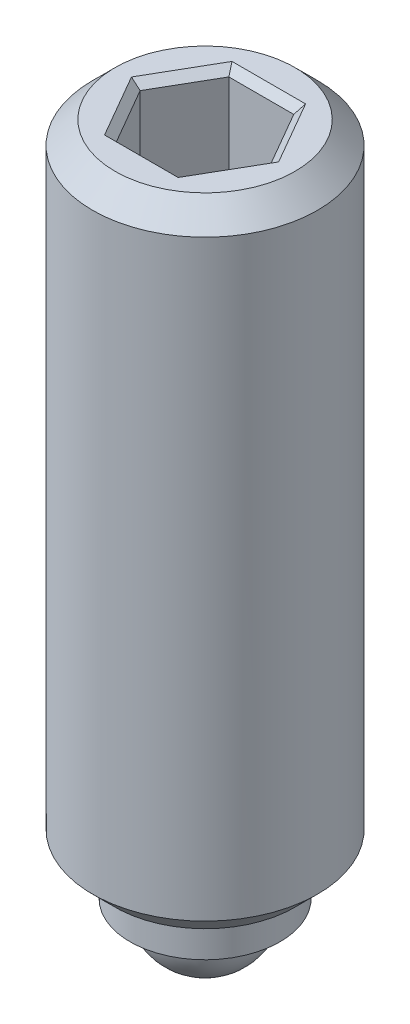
SolidWorks part; units mm, degrees
ref_plane "Plan de face" through (0, 0, 0) normal (0, 0, 1) x (1, 0, 0)
ref_plane "Plan de dessus" through (0, 0, 0) normal (0, 1, 0) x (1, 0, 0)
ref_plane "Plan de droite" through (0, 0, 0) normal (1, 0, 0) x (0, 0, -1)
sketch "Esquisse1" plane through (0, 0, 0) normal (0, 0, 1) x (1, 0, 0)
  line L0 (0, 0) -> (0, 9)
  line L1 (0, 9) -> (1.5, 9)
  line L2 (1.5, 9) -> (1.5, 0.5)
  line L3 (1.5, 0.5) -> (1, 0.5)
  line L4 (1, 0.5) -> (1, 0)
  line L5 (1, 0) -> (0, 0)
  point P3 (1.25, 0.5)
  dimension "DIAMETRE" = 1.5
  dimension "L1" = 8.5
  dimension "L2" = 0.5
  dimension "DIAMETRE2" = 1
revolve "Révolution1" add sketch "Esquisse1" angle 360 about L0
sketch "Esquisse2" plane through (0, 0, 0) normal (0, 0, 1) x (1, 0, 0)
  line L0 (0, -0.75) -> (0, 0.75)
  arc A0 (0, -0.75) -> (0, 0.75) centre (0, 0) ccw
  dimension "SPHERE" = 1.5
revolve "Révolution2" add sketch "Esquisse2" angle 360 about L0
chamfer "Chanfrein1" distance 0.3 angle 45 1 edges at (0, 9, -1.5)
chamfer "Chanfrein3" distance 0.3 angle 45 1 edges at (0, 0.5, -1.5)
sketch "Esquisse3" plane through (0, 9, 0) normal (0, 1, 0) x (1, 0, 0)
  line L0 (0, 0) -> (0.866, 0) construction
  line L1 (0.866, 0) -> (0.433, 0.75)
  line L2 (0.433, 0.75) -> (-0.433, 0.75)
  line L3 (-0.433, 0.75) -> (-0.866, 0)
  line L4 (-0.866, 0) -> (-0.433, -0.75)
  line L5 (-0.433, -0.75) -> (0.433, -0.75)
  line L6 (0.433, -0.75) -> (0.866, 0)
  circle A0 centre (0, 0) radius 0.75 construction
  dimension "LARGEUR OUTIL" = 1.5
extrude "Enlèv. mat.-Extru.1" cut sketch "Esquisse3" against normal blind 3
chamfer "Chanfrein2" distance 0.1 angle 45 6 edges at (0, 9, -0.75) (0.6495, 9, -0.375) (-0.6495, 9, -0.375) (-0.6495, 9, 0.375) (0, 9, 0.75) (0.6495, 9, 0.375)
